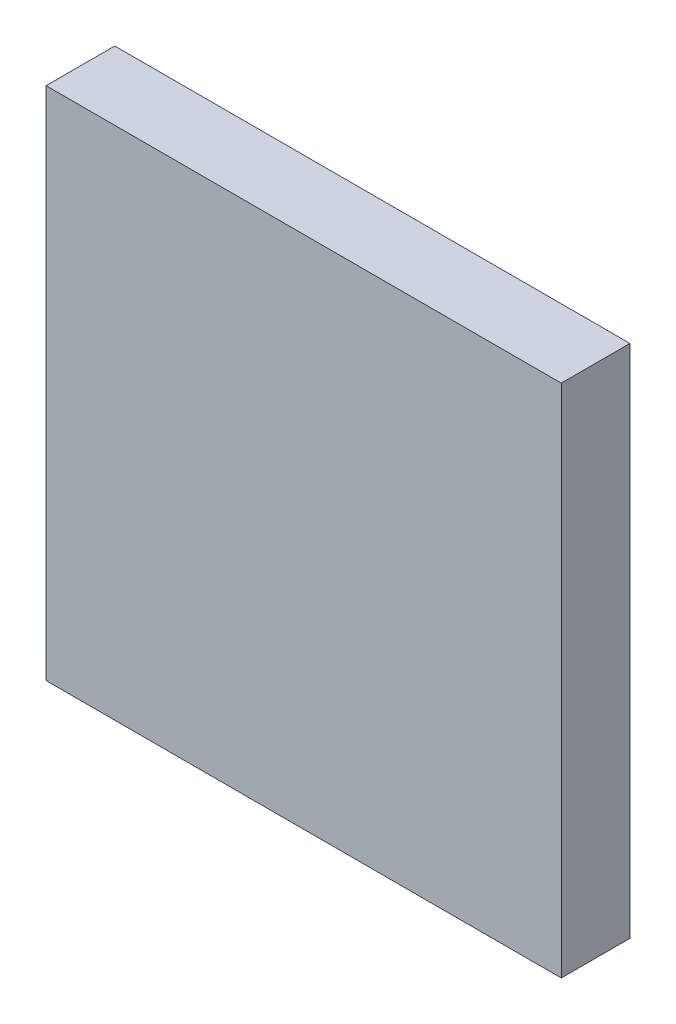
SolidWorks part; units mm, degrees
ref_plane "Front Plane" through (0, 0, 0) normal (0, 0, 1) x (1, 0, 0)
ref_plane "Top Plane" through (0, 0, 0) normal (0, 1, 0) x (1, 0, 0)
ref_plane "Right Plane" through (0, 0, 0) normal (1, 0, 0) x (0, 0, -1)
sketch "Sketch1" plane through (0, 0, 0) normal (0, 0, 1) x (1, 0, 0)
  line L1 (0, 0) -> (7.5, 0)
  line L2 (0, 0) -> (0, -7.5)
  line L3 (0, -7.5) -> (7.5, -7.5)
  line L4 (7.5, 0) -> (7.5, -7.5)
  dimension "D1" = 7.5
  dimension "D2" = 7.5
extrude "Boss-Extrude1" add sketch "Sketch1" along normal blind 1 contours L3 L4 L1 L2
